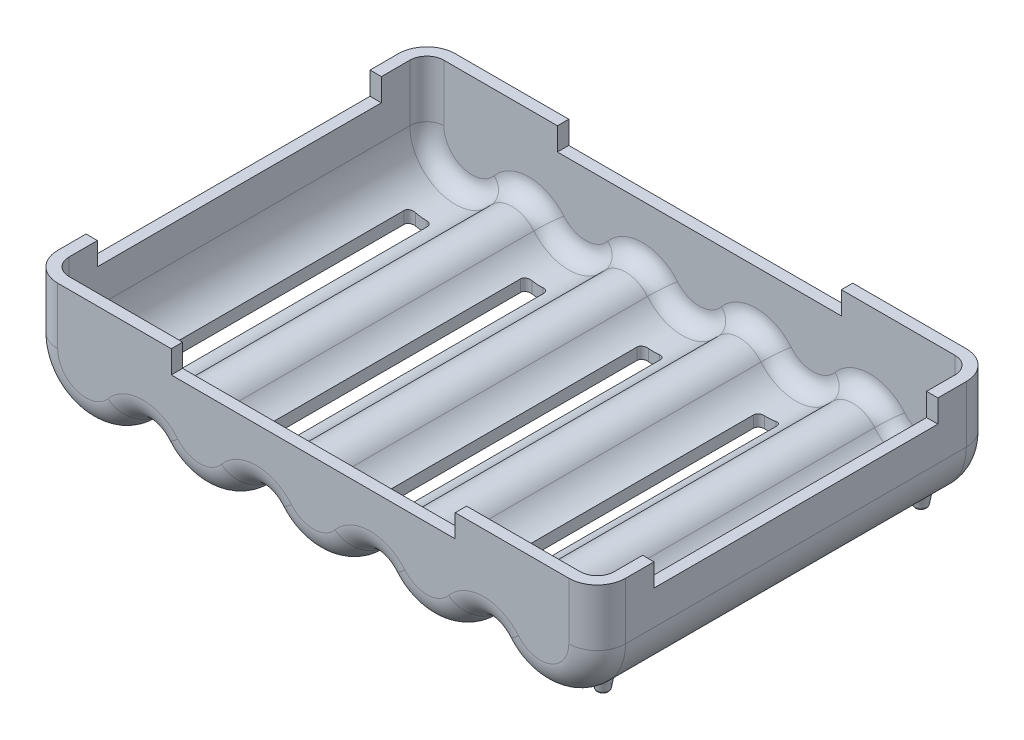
SolidWorks part; units mm, degrees
ref_plane "Front Plane" through (0, 0, 0) normal (0, 0, 1) x (1, 0, 0)
ref_plane "Top Plane" through (0, 0, 0) normal (0, 1, 0) x (1, 0, 0)
ref_plane "Right Plane" through (0, 0, 0) normal (1, 0, 0) x (0, 0, -1)
sketch "Sketch1" plane through (0, 0, 0) normal (0, 0, 1) x (1, 0, 0)
  line L1 (-25, 0) -> (25, 0)
  line L2 (-25, 0) -> (-25, -5)
  line L4 (25, 0) -> (25, -5)
  arc A0 (-16.1538, -8.1949) -> (-25, -5) centre (-20, -5) cw
  arc A1 (-6.1538, -8.1949) -> (-13.8462, -8.1949) centre (-10, -5) cw
  arc A2 (3.8462, -8.1949) -> (-3.8462, -8.1949) centre (0, -5) cw
  arc A3 (13.8462, -8.1949) -> (6.1538, -8.1949) centre (10, -5) cw
  arc A4 (25, -5) -> (16.1538, -8.1949) centre (20, -5) cw
  arc A5 (13.8462, -8.1949) -> (16.1538, -8.1949) centre (15, -9.1533) cw
  arc A6 (3.8462, -8.1949) -> (6.1538, -8.1949) centre (5, -9.1533) cw
  arc A7 (-6.1538, -8.1949) -> (-3.8462, -8.1949) centre (-5, -9.1533) cw
  arc A8 (-13.8462, -8.1949) -> (-16.1538, -8.1949) centre (-15, -9.1533) ccw
  point P4 (0, 0)
  point P21 (0, 0)
  point P24 (-15, -5)
  dimension "D3" = 5
  dimension "D5" = 1.5
  dimension "D6" = 1.5
  dimension "D7" = 1.5
  dimension "D8" = 1.5
  dimension "D1" = 50
  dimension "D2" = 5
  dimension "D4" = 5
extrude "Boss-Extrude1" add sketch "Sketch1" along normal mid plane 35
fillet "Fillet1" radius 2.5 22 edges at (-25, -2.5, -17.5) (-21.6984, -9.7027, -17.5) (-15, -7.6533, -17.5) (-10, -10, -17.5) (-5, -7.6533, -17.5) (25, -2.5, -17.5) (21.6984, -9.7027, -17.5) (15, -7.6533, -17.5) (10, -10, -17.5) (5, -7.6533, -17.5) (-25, -2.5, 17.5) (-21.6984, -9.7027, 17.5) (-15, -7.6533, 17.5) (-10, -10, 17.5) (-5, -7.6533, 17.5) (25, -2.5, 17.5) (21.6984, -9.7027, 17.5) (15, -7.6533, 17.5) (10, -10, 17.5) (5, -7.6533, 17.5) (0, -10, -17.5) (0, -10, 17.5)
shell "Shell1" thickness 1
sketch "Sketch2" plane through (0, 0, 0) normal (0, 0, 1) x (1, 0, 0)
  line L1 (-12.5, 2) -> (12.5, 2)
  line L2 (-12.5, 2) -> (-12.5, -2)
  line L3 (-12.5, -2) -> (12.5, -2)
  line L4 (12.5, 2) -> (12.5, -2)
  line L5 (-12.5, 2) -> (12.5, -2) construction
  line L6 (-12.5, -2) -> (12.5, 2) construction
  point P0 (0, 0)
  dimension "D1" = 25
  dimension "D2" = 4
extrude "Cut-Extrude1" cut sketch "Sketch2" against normal through all both and the other way through all
sketch "Sketch4" plane through (25, 0, 0) normal (1, 0, 0) x (0, 0, -1)
  line L0 (-15, 0) -> (15, 0) construction
  line L1 (-12.5, 2) -> (12.5, 2)
  line L2 (-12.5, 2) -> (-12.5, -2)
  line L3 (-12.5, -2) -> (12.5, -2)
  line L4 (12.5, 2) -> (12.5, -2)
  line L5 (-12.5, 2) -> (12.5, -2) construction
  line L6 (-12.5, -2) -> (12.5, 2) construction
  point P0 (0, 0)
  point P6 (0, 0)
  point P9 (0, 0)
  dimension "D1" = 25
  dimension "D2" = 4
extrude "Cut-Extrude2" cut sketch "Sketch4" against normal through all
sketch "Sketch5" plane through (0, 0, 0) normal (0, 1, 0) x (1, 0, 0)
  line L0 (-25, -12.5) -> (-25, 12.5) construction
  line L1 (-21, 12.5) -> (-20, 12.5)
  line L2 (-21.5, 12) -> (-21.5, -12)
  line L3 (-21, -12.5) -> (-20, -12.5)
  line L4 (-19.5, 12) -> (-19.5, -12)
  line L5 (-12.5, 17.5) -> (-22.5, 17.5) construction
  line L6 (-11.25, 12) -> (-11.25, -12)
  line L7 (-10.75, 12.5) -> (-9.75, 12.5)
  line L8 (-9.25, 12) -> (-9.25, -12)
  line L9 (-10.75, -12.5) -> (-9.75, -12.5)
  line L10 (-1, 12) -> (-1, -12)
  line L11 (-0.5, 12.5) -> (0.5, 12.5)
  line L12 (1, 12) -> (1, -12)
  line L13 (-0.5, -12.5) -> (0.5, -12.5)
  line L14 (9.25, 12) -> (9.25, -12)
  line L15 (9.75, 12.5) -> (10.75, 12.5)
  line L16 (11.25, 12) -> (11.25, -12)
  line L17 (9.75, -12.5) -> (10.75, -12.5)
  line L18 (19.5, 12) -> (19.5, -12)
  line L19 (20, 12.5) -> (21, 12.5)
  line L20 (21.5, 12) -> (21.5, -12)
  line L21 (20, -12.5) -> (21, -12.5)
  arc A0 (-21, -12.5) -> (-21.5, -12) centre (-21, -12) cw
  arc A1 (-19.5, -12) -> (-20, -12.5) centre (-20, -12) cw
  arc A2 (-20, 12.5) -> (-19.5, 12) centre (-20, 12) cw
  arc A3 (-21, 12.5) -> (-21.5, 12) centre (-21, 12) ccw
  arc A4 (20, -12.5) -> (19.5, -12) centre (20, -12) cw
  arc A5 (21.5, -12) -> (21, -12.5) centre (21, -12) cw
  arc A6 (21, 12.5) -> (21.5, 12) centre (21, 12) cw
  arc A7 (20, 12.5) -> (19.5, 12) centre (20, 12) ccw
  arc A8 (9.75, 12.5) -> (9.25, 12) centre (9.75, 12) ccw
  arc A9 (11.25, 12) -> (10.75, 12.5) centre (10.75, 12) ccw
  arc A10 (10.75, -12.5) -> (11.25, -12) centre (10.75, -12) ccw
  arc A11 (9.75, -12.5) -> (9.25, -12) centre (9.75, -12) cw
  arc A12 (-0.5, -12.5) -> (-1, -12) centre (-0.5, -12) cw
  arc A13 (1, -12) -> (0.5, -12.5) centre (0.5, -12) cw
  arc A14 (0.5, 12.5) -> (1, 12) centre (0.5, 12) cw
  arc A15 (-0.5, 12.5) -> (-1, 12) centre (-0.5, 12) ccw
  arc A16 (-10.75, -12.5) -> (-11.25, -12) centre (-10.75, -12) cw
  arc A17 (-9.25, -12) -> (-9.75, -12.5) centre (-9.75, -12) cw
  arc A18 (-9.75, 12.5) -> (-9.25, 12) centre (-9.75, 12) cw
  arc A19 (-10.75, 12.5) -> (-11.25, 12) centre (-10.75, 12) ccw
  point P26 (-21.5, -12.5)
  point P31 (-19.5, 12.5)
  point P34 (-21.5, 12.5)
  dimension "D6" = 0.5
  dimension "D7" = 0.5
  dimension "D8" = 0.5
  dimension "D9" = 0.5
  dimension "D10" = 0.5
  dimension "D11" = 0.5
  dimension "D12" = 0.5
  dimension "D13" = 0.5
  dimension "D14" = 0.5
  dimension "D15" = 0.5
  dimension "D16" = 0.5
  dimension "D17" = 0.5
  dimension "D18" = 0.5
  dimension "D19" = 0.5
  dimension "D20" = 0.5
  dimension "D21" = 0.5
  dimension "D22" = 0.5
  dimension "D23" = 0.5
  dimension "D24" = 0.5
  dimension "D25" = 0.5
  dimension "D1" = 25
  dimension "D2" = 2
  dimension "D3" = 3.5
  dimension "D4" = 5
  dimension "D5" = 5
extrude "Cut-Extrude3" cut sketch "Sketch5" against normal through all
ref_plane "Plane1" through (0, -10.5, 0) normal (0, 1, 0) x (1, 0, 0)
sketch "Sketch6" plane through (0, -10.5, 0) normal (0, 1, 0) x (1, 0, 0)
  line L0 (-25, -15) -> (-25, 15) construction
  line L1 (-18.0769, -17.5) -> (-11.9231, -17.5) construction
  line L2 (18.0769, -17.5) -> (22.5, -17.5) construction
  line L3 (25, -15) -> (25, 15) construction
  line L4 (22.5, 17.5) -> (18.0769, 17.5) construction
  line L5 (-18.0769, 17.5) -> (-22.5, 17.5) construction
  circle A0 centre (-22, -14) radius 0.5
  circle A1 centre (22, -14) radius 0.5
  circle A2 centre (22, 14) radius 0.5
  circle A3 centre (-22, 14) radius 0.5
  dimension "D1" = 1
  dimension "D2" = 3
  dimension "D3" = 3.5
  dimension "D5" = 3
  dimension "D6" = 3
  dimension "D7" = 3.5
  dimension "D8" = 3
  dimension "D9" = 3.5
  dimension "D4" = 3.5
extrude "Boss-Extrude2" add sketch "Sketch6" along normal up to next draft 10
fillet "Fillet2" radius 0.25 4 edges at (-22, -10.5, -13.5) (-22, -10.5, 14.5) (22, -10.5, 14.5) (22, -10.5, -13.5)
